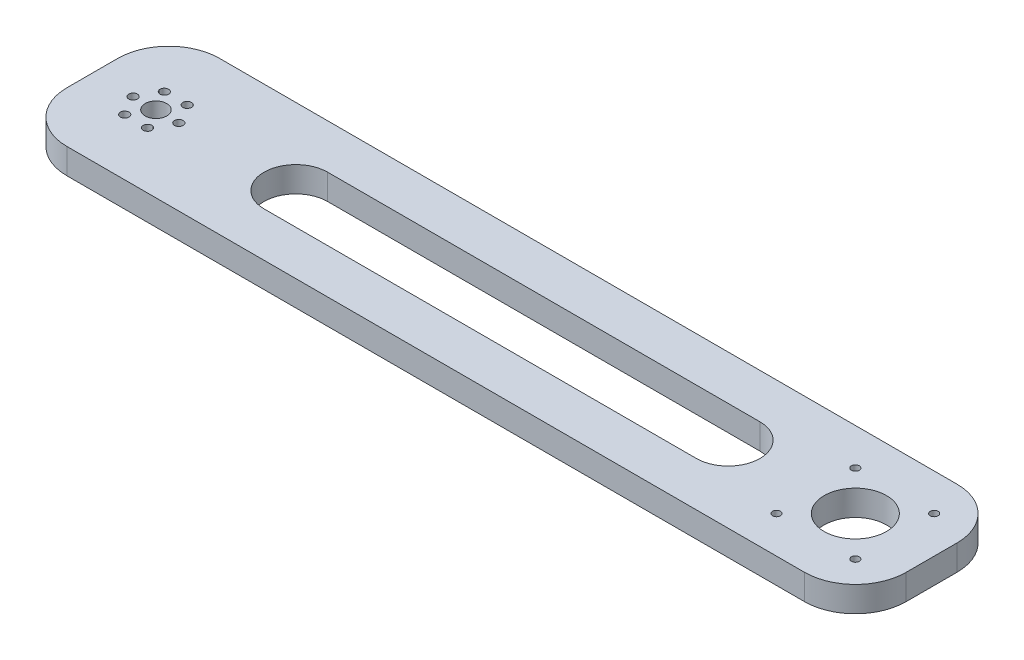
SolidWorks part; units mm, degrees
ref_plane "前视基准面" through (0, 0, 0) normal (0, 0, 1) x (1, 0, 0)
ref_plane "上视基准面" through (0, 0, 0) normal (0, 1, 0) x (1, 0, 0)
ref_plane "右视基准面" through (0, 0, 0) normal (1, 0, 0) x (0, 0, -1)
other "Configuration Table"
sketch "草图1" plane through (0, 0, 0) normal (0, 1, 0) x (1, 0, 0)
  line L1 (-165, -30) -> (165, -30)
  line L2 (-165, -30) -> (-165, 30)
  line L3 (-165, 30) -> (165, 30)
  line L4 (165, -30) -> (165, 30)
  line L5 (-165, -30) -> (165, 30) construction
  line L6 (-165, 30) -> (165, -30) construction
  point P0 (0, 0)
  dimension "D1" = 330
  dimension "D2" = 60
extrude "凸台-拉伸1" add sketch "草图1" along normal blind 10
fillet "圆角1" radius 20 4 edges at (165, 5, 30) (165, 5, -30) (-165, 5, -30) (-165, 5, 30)
sketch "草图5" plane through (0, 10, 0) normal (0, 1, 0) x (1, 0, 0)
  line L0 (165, 0) -> (-165, 0) construction
  line L1 (165, -10) -> (165, 10) construction
  line L2 (-165, 10) -> (-165, -10) construction
  circle A0 centre (135, 0) radius 12.25
  dimension "D1" = 24.5
  dimension "D2" = 30
extrude "切除-拉伸3" cut sketch "草图5" against normal blind 12
sketch "草图9" plane through (0, 0, 0) normal (0, -1, 0) x (1, 0, 0)
  circle A0 centre (119.5, 15.5) radius 1.55
  circle A1 centre (150.5, 15.5) radius 1.55
  circle A2 centre (150.5, -15.5) radius 1.55
  circle A3 centre (119.5, -15.5) radius 1.55
  dimension "D1" = 3.1
  dimension "D2" = 3.1
  dimension "D3" = 3.1
  dimension "D4" = 3.1
extrude "切除-拉伸6" cut sketch "草图9" against normal through all
sketch "草图11" plane through (0, 0, 0) normal (0, -1, 0) x (1, 0, 0)
  line L0 (-145, 30) -> (145, 30) construction
  line L1 (-165, -10) -> (-165, 10) construction
  circle A0 centre (-140, 0) radius 4.25
  dimension "D1" = 8.5
  dimension "D2" = 30
  dimension "D3" = 25
extrude "切除-拉伸8" cut sketch "草图11" against normal through all
sketch "草图15" plane through (0, 0, 0) normal (0, -1, 0) x (1, 0, 0)
  line L0 (-85, 0) -> (85, 0) construction
  line L1 (-85, 12.5) -> (85, 12.5)
  line L2 (-85, -12.5) -> (85, -12.5)
  arc A0 (-85, 12.5) -> (-85, -12.5) centre (-85, 0) ccw
  arc A1 (85, -12.5) -> (85, 12.5) centre (85, 0) ccw
  point P2 (0, 0)
  dimension "D1" = 170
  dimension "D2" = 25
extrude "切除-拉伸11" cut sketch "草图15" against normal through all
sketch "草图16" plane through (0, 0, 0) normal (0, -1, 0) x (1, 0, 0)
  circle A0 centre (-140, 0) radius 9 construction
  circle A1 centre (-149, 0) radius 1.7
  dimension "D1" = 18
  dimension "D2" = 3.4
extrude "切除-拉伸12" cut sketch "草图16" against normal through all
pattern_circular "阵列(圆周)1" count 6 every 60 about axis through (-140, 0, 0) along (0, 1, 0) of "切除-拉伸12"
